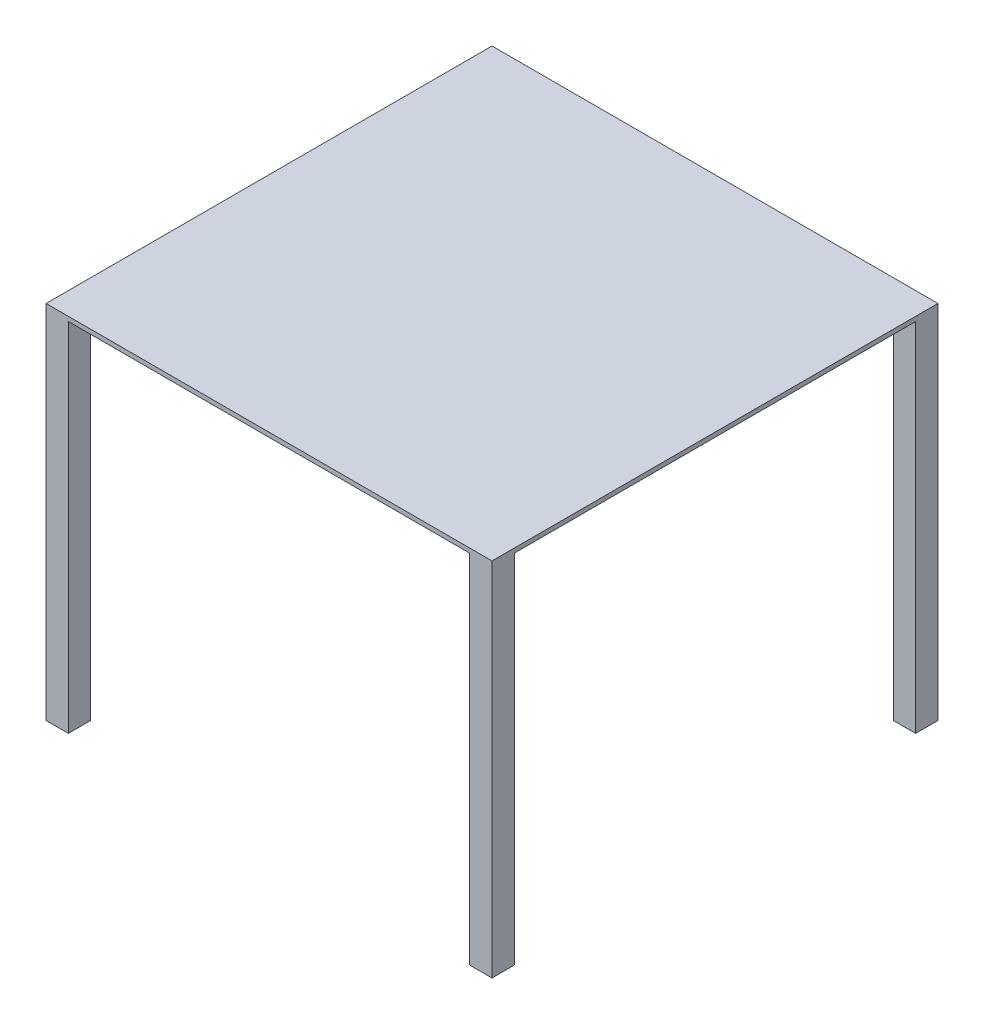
SolidWorks part; units mm, degrees
ref_plane "Face" through (0, 0, 0) normal (0, 0, 1) x (1, 0, 0)
ref_plane "Dessus" through (0, 0, 0) normal (0, 1, 0) x (1, 0, 0)
ref_plane "Droite" through (0, 0, 0) normal (1, 0, 0) x (0, 0, -1)
sketch "Esquisse1" plane through (0, 0, 0) normal (0, 0, 1) x (1, 0, 0)
  line L1 (-125.5028, -1.4093) -> (874.4972, -1.4093)
  line L2 (-125.5028, -1.4093) -> (-125.5028, -11.4093)
  line L3 (-125.5028, -11.4093) -> (874.4972, -11.4093)
  line L4 (874.4972, -1.4093) -> (874.4972, -11.4093)
  dimension "D1" = 1000
  dimension "D2" = 10
extrude "Base-Extrusion" add sketch "Esquisse1" along normal blind 1000
sketch "Esquisse2" plane through (0, -11.4093, 0) normal (0, -1, 0) x (1, 0, 0)
  line L0 (874.4972, 1000) -> (874.4972, 0) construction
  line L1 (874.4972, 1000) -> (824.4972, 1000)
  line L2 (874.4972, 1000) -> (874.4972, 950)
  line L3 (874.4972, 950) -> (824.4972, 950)
  line L4 (824.4972, 1000) -> (824.4972, 950)
  line L5 (874.4972, 50) -> (824.4972, 50)
  line L6 (874.4972, 50) -> (874.4972, 0)
  line L7 (874.4972, 0) -> (824.4972, 0)
  line L8 (824.4972, 50) -> (824.4972, 0)
  line L9 (-125.5028, 0) -> (874.4972, 0) construction
  line L10 (-125.5028, 1000) -> (874.4972, 1000) construction
  line L11 (-75.5028, 50) -> (-125.5028, 50)
  line L12 (-75.5028, 50) -> (-75.5028, 0)
  line L13 (-75.5028, 0) -> (-125.5028, 0)
  line L14 (-125.5028, 50) -> (-125.5028, 0)
  line L15 (-75.5028, 1000) -> (-125.5028, 1000)
  line L16 (-75.5028, 1000) -> (-75.5028, 950)
  line L17 (-75.5028, 950) -> (-125.5028, 950)
  line L18 (-125.5028, 1000) -> (-125.5028, 950)
  line L19 (-125.5028, 1000) -> (-125.5028, 0) construction
  dimension "D1" = 50
  dimension "D2" = 50
  dimension "D3" = 50
  dimension "D4" = 50
  dimension "D5" = 50
  dimension "D6" = 50
  dimension "D7" = 50
  dimension "D8" = 50
extrude "Boss.-Extru.1" add sketch "Esquisse2" along normal blind 800
